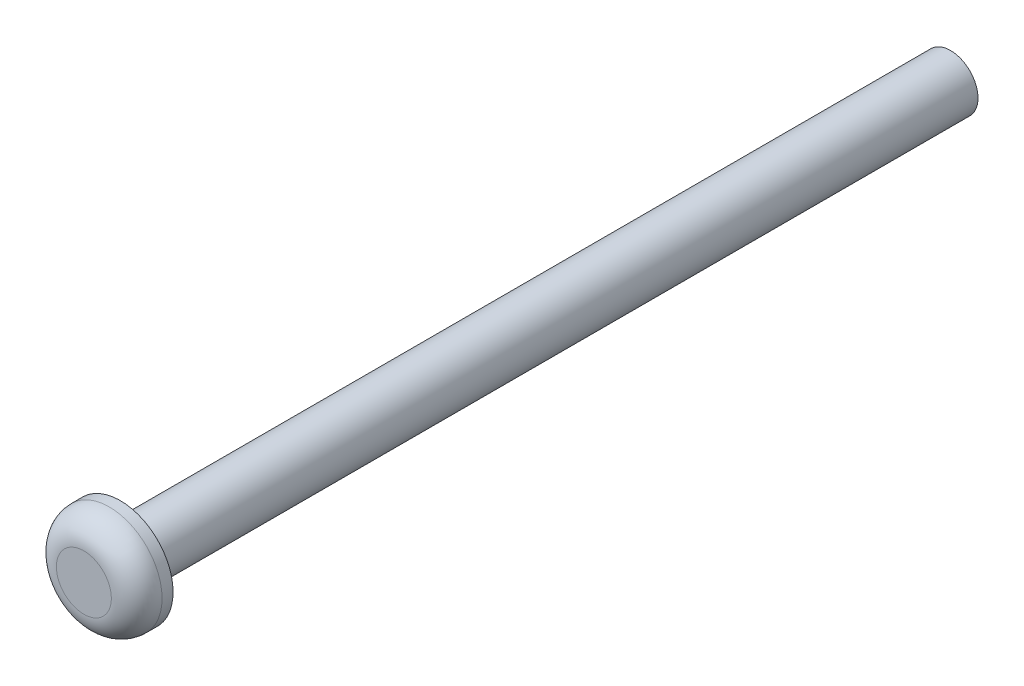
SolidWorks part; units mm, degrees
ref_plane "Front Plane" through (0, 0, 0) normal (0, 0, 1) x (1, 0, 0)
ref_plane "Top Plane" through (0, 0, 0) normal (0, 1, 0) x (1, 0, 0)
ref_plane "Right Plane" through (0, 0, 0) normal (1, 0, 0) x (0, 0, -1)
sketch "Sketch1" plane through (0, 0, 0) normal (0, 0, 1) x (1, 0, 0)
  circle A0 centre (0, 0) radius 3.175
  dimension "D1" = 6.35
extrude "Boss-Extrude1" add sketch "Sketch1" along normal blind 2.1844
sketch "Sketch3" plane through (0, 0, 2.1844) normal (0, 0, 1) x (1, 0, 0)
  circle A0 centre (0, 0) radius 1.651
  dimension "D1" = 3.302
extrude "Boss-Extrude2" add sketch "Sketch3" against normal blind 52.07
fillet "Fillet1" radius 1.524 1 edges at (3.175, 0, 2.1844)
